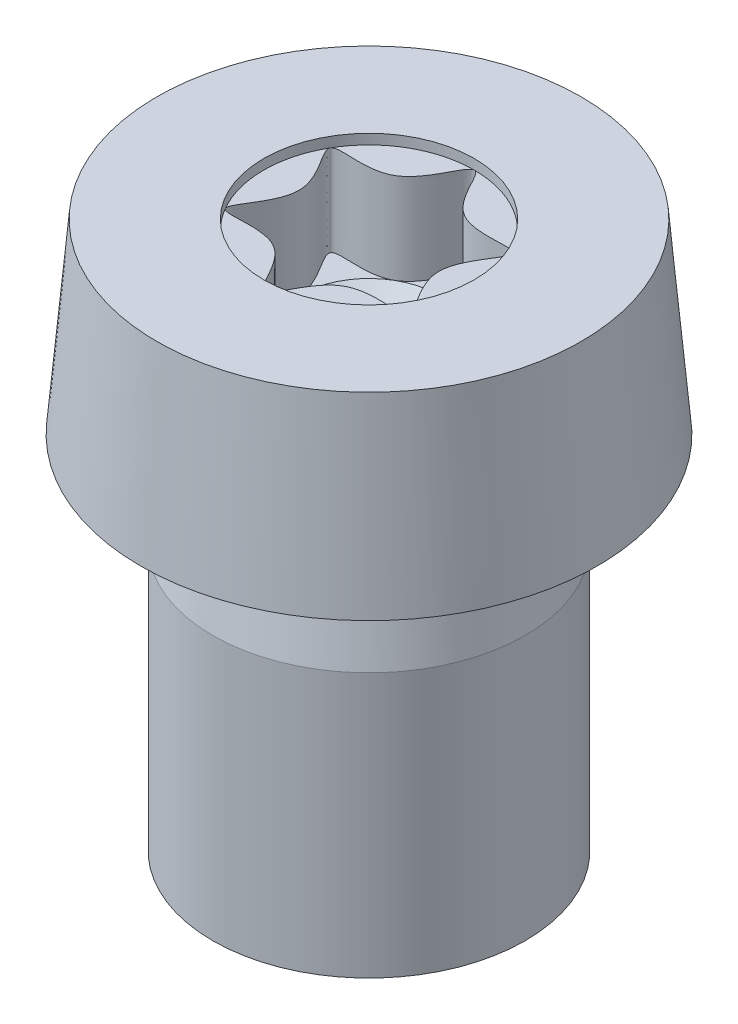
SolidWorks part; units mm, degrees
ref_plane "Front" through (0, 0, 0) normal (0, 0, 1) x (1, 0, 0)
ref_plane "Top" through (0, 0, 0) normal (0, 1, 0) x (1, 0, 0)
ref_plane "Right" through (0, 0, 0) normal (1, 0, 0) x (0, 0, -1)
sketch "Sketch1" plane through (0, 0, 0) normal (0, 0, 1) x (1, 0, 0)
  line L0 (0, 0) -> (0, 5.1006) construction
  line L1 (0, 4.55) -> (1.7644, 4.55)
  line L2 (1.7644, 4.55) -> (1.9, 3)
  line L3 (1.9, 3) -> (1.3, 3)
  line L4 (1.3, 0) -> (1.3, 2.2)
  line L5 (1.3, 0) -> (0, 0)
  line L6 (0, 0) -> (0, 4.55)
  line L7 (1.9, 3) -> (1.9, 2.6) construction
  line L8 (1.3, 2.2) -> (1.14, 3)
  line L9 (1.14, 3) -> (1.3, 3)
  line L10 (1.9, 2.6) -> (1.9, 0.6) construction
  dimension "D2" = 0.16
  dimension "D1" = 5
  dimension "length" = 3
  dimension "head_ht" = 1.55
  dimension "head_dia" = 3.8
  dimension "dia" = 2.6
  dimension "pitch" = 0.4
  dimension "thread_gap" = 0.8
  dimension "thread_length" = 2
revolve "Body-Revolve" add sketch "Sketch1" angle 360 about L0
fillet "Fillet1" radius 0.1 1 edges at (0, 3, -1.14)
sketch "Sketch2" plane through (0, 4.55, 0) normal (0, 1, 0) x (-1, 0, 0)
  line L0 (0, -0.9625) -> (0, 0)
  line L1 (0, 0) -> (-0.4375, -0.7578)
  circle A0 centre (0, 0) radius 0.875
  circle A1 centre (0, 0) radius 0.5833
  spline S0 degree 3 poles (0.1887, -0.3269) (0, -1.1491) (-0.1887, -0.3269) (-0.9951, -0.5745) (-0.3774, 0) (-0.9951, 0.5745) (-0.1887, 0.3269) (0, 1.1491) (0.1887, 0.3269) (0.9951, 0.5745) (0.3774, 0) (0.9951, -0.5745) (0.1887, -0.3269) (0, -1.1491) (-0.1887, -0.3269) knots -0.25 -0.166667 -0.083333 0 0.083333 0.166667 0.25 0.333333 0.416667 0.5 0.583333 0.666667 0.75 0.833333 0.916667 1 1.083333 1.166667 1.25 only from (0, -0.875) to (0, -0.875)
  point P5 (0, -0.875)
  point P7 (-0.2917, -0.5052)
  point P10 (-0.7578, -0.4375)
  point P11 (-0.7578, 0.4375)
  point P12 (0, 0.875)
  point P13 (0.7578, 0.4375)
  point P14 (0.7578, -0.4375)
  point P15 (-0.5833, 0)
  point P16 (-0.2917, 0.5052)
  point P17 (0.2917, 0.5052)
  point P18 (0.5833, 0)
  point P19 (0.2917, -0.5052)
  dimension "D1" = 1.1667
  dimension "socket_dia" = 1.75
  dimension "D2" = 0.9625
  dimension "D3" = 30
extrude "Socket-Cut-Extrude1" cut sketch "Sketch2" against normal blind 0.84 contours S0
sketch "Sketch3" plane through (0, 4.55, 0) normal (0, 1, 0) x (-1, 0, 0)
  circle A0 centre (0, 0) radius 0.875
  dimension "D1" = 1.75
extrude "Socket-Cut-Extrude2" cut sketch "Sketch3" against normal blind 0.084
sketch "Sketch4" plane through (0, 0, 0) normal (0, 0, 1) x (1, 0, 0)
  line L0 (0, 3.71) -> (0.5833, 3.71)
  line L1 (0.761, 3.71) -> (-0.761, 3.71) construction
  line L2 (0.5833, 3.71) -> (0, 3.155)
  line L3 (0, 0) -> (0, 5.1006) construction
  line L4 (0, 3.155) -> (0, 3.71)
  line L5 (0.875, 4.55) -> (-0.875, 4.55) construction
  dimension "D1" = 1.395
  dimension "D2" = 0.5833
revolve "Drill-Cut-Revolve" cut sketch "Sketch4" angle 360 about axis through (0, 0, 0) along (0, 1, 0)
sketch "Sketch5" plane through (0, 0, 0) normal (0, 0, 1) x (1, 0, 0)
  line L0 (1.3, 0) -> (1.0835, 0.125)
  line L1 (1.0835, 0.125) -> (1.3, 0.25)
  line L2 (1.3, 0) -> (1.3, 2.2) construction
  line L3 (1.3, 0.25) -> (1.3, 0)
  line L4 (0, 0) -> (0, 5.1006) construction
  dimension "D1" = 1.0835
revolve "ThreadSchematic" [suppressed] cut sketch "Sketch5" angle 360 about axis through (0, 0, 0) along (0, 1, 0)
pattern_linear "ThdSchPat" [suppressed] count 5 spacing 0.4 along (0, 1, 0)
equation "\"D2@Sketch1\" = 0.2*\"thread_gap@Sketch1\""
equation "\"D1@Sketch2\" = \"socket_dia@Sketch2\" / 1.5"
equation "\"D2@Sketch2\" = \"socket_dia@Sketch2\" / 2 * 1.1"
equation "\"D1@Sketch3\" =\"socket_dia@Sketch2\""
equation "\"D1@Socket-Cut-Extrude2\" = .1 * \"socket_dep@Socket-Cut-Extrude1\""
equation "\"D1@Sketch4\" = 0.9*\"head_ht@Sketch1\""
equation "\"D2@Sketch4\" = \"D1@Sketch2\" / 2"
equation "\"D1@ThreadCosmetic\" = \"thread_length@Sketch1\""
equation "\"D2@ThreadCosmetic\" = \"dia@Sketch1\" - 1.0825 * \"pitch@Sketch1\""
equation "\"D1@Sketch5\" = \"D2@ThreadCosmetic\" / 2"
equation "\"D3@ThdSchPat\" = \"pitch@Sketch1\""
equation "\"D1@ThdSchPat\" = \"thread_length@Sketch1\" / \"pitch@Sketch1\""
